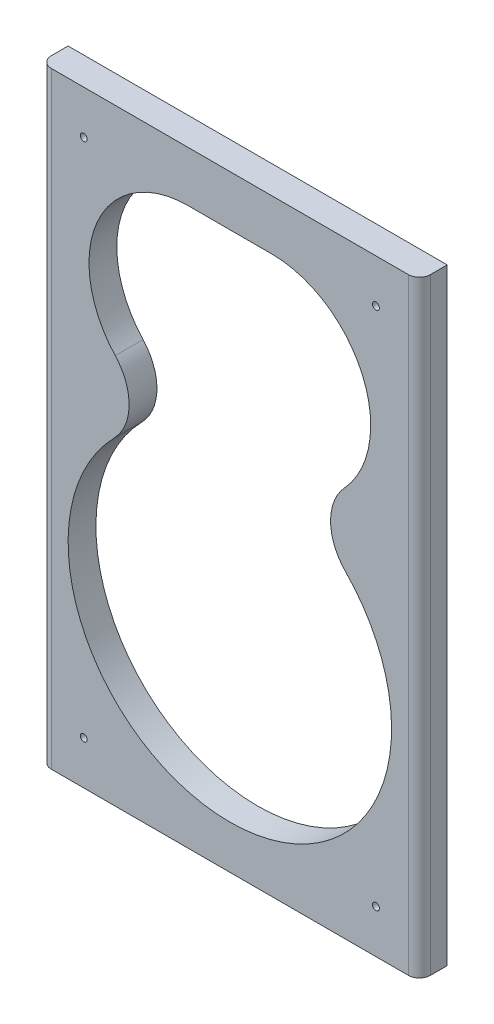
SolidWorks part; units mm, degrees
ref_plane "Спереди" through (0, 0, 0) normal (0, 0, 1) x (1, 0, 0)
ref_plane "Сверху" through (0, 0, 0) normal (0, 1, 0) x (1, 0, 0)
ref_plane "Справа" through (0, 0, 0) normal (1, 0, 0) x (0, 0, -1)
sketch "Эскиз1" plane through (0, 0, 0) normal (0, 0, 1) x (1, 0, 0)
  line L1 (16, 349) -> (224, 349) construction
  line L2 (229, 16) -> (11, 16)
  line L3 (224, 16) -> (16, 16) construction
  line L4 (0, 365) -> (240, 365) construction
  line L6 (96, 336.0027) -> (144, 336.0027)
  line L8 (11, 365) -> (229, 365)
  line L12 (11, 16) -> (11, 365)
  line L13 (229, 365) -> (229, 16)
  line L14 (16, 16) -> (16, 349) construction
  line L15 (224, 349) -> (224, 16) construction
  line L16 (120, 179.151) -> (120, 306.634) construction
  line L19 (0, 0) -> (0, 365) construction
  line L20 (240, 365) -> (240, 0) construction
  line L21 (240, 0) -> (0, 0) construction
  circle A0 centre (120, 134.0027) radius 88 construction
  arc A2 (186.4893, 199.0271) -> (185.8901, 240.3475) centre (207.9375, 220.0027) cw
  arc A3 (53.5107, 199.0271) -> (54.1099, 240.3475) centre (32.0625, 220.0027) ccw
  arc A4 (185.8901, 240.3475) -> (144, 336.0027) centre (144, 279.0027) ccw
  arc A6 (53.5107, 199.0271) -> (186.4893, 199.0271) centre (120, 134.0027) ccw
  arc A7 (120.66, 227.0003) -> (119.34, 227.0003) centre (120, 134.0027) ccw construction
  arc A9 (96, 336.0027) -> (54.1099, 240.3475) centre (96, 279.0027) ccw
  dimension "D1" = 176
  dimension "D3" = 30
  dimension "D2" = 24
extrude "Бобышка-Вытянуть1" add sketch "Эскиз1" along normal blind 16
fillet "Скругление1" radius 6.35 2 edges at (11, 190.5, 16) (229, 190.5, 16)
sketch "Эскиз2" plane through (0, 0, 0) normal (0, 0, -1) x (-1, 0, 0)
  circle A2 centre (-204, 340) radius 2
  circle A3 centre (-36, 340) radius 2
  circle A4 centre (-204, 41) radius 2
  circle A5 centre (-36, 41) radius 2
extrude "Вырез-Вытянуть1" cut sketch "Эскиз2" against normal blind 16
